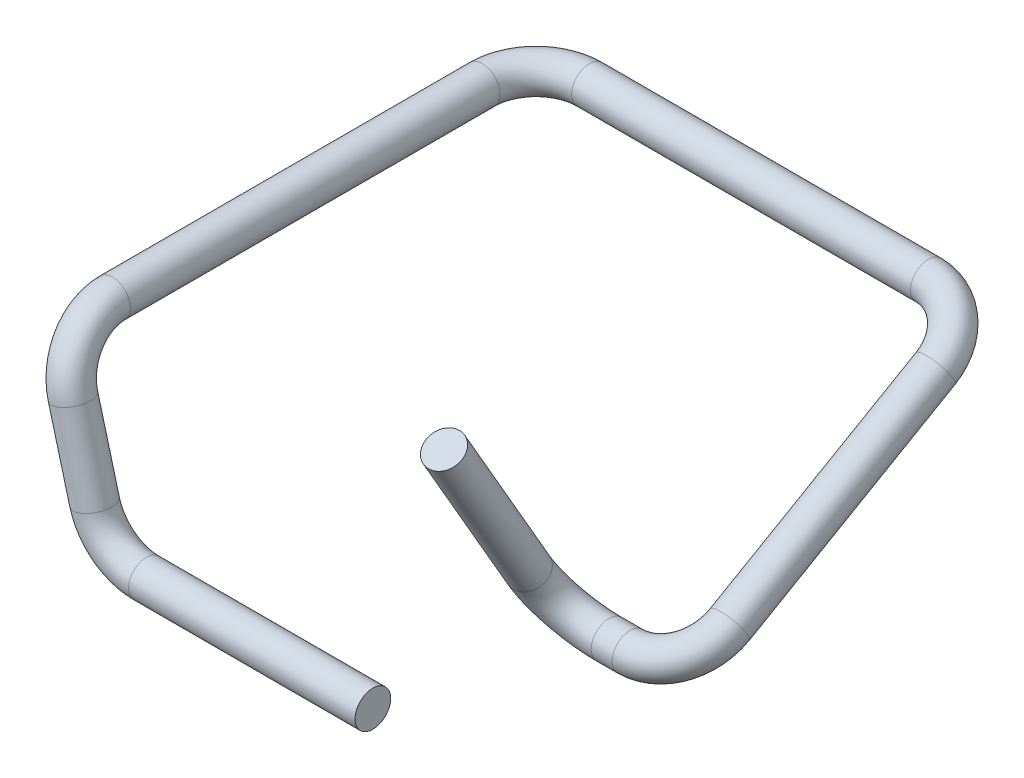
SolidWorks part; units mm, degrees
ref_plane "Front" through (0, 0, 0) normal (0, 0, 1) x (1, 0, 0)
ref_plane "Top" through (0, 0, 0) normal (0, 1, 0) x (1, 0, 0)
ref_plane "Right" through (0, 0, 0) normal (1, 0, 0) x (0, 0, -1)
sketch "setup" plane through (0, 0, 0) normal (0, 1, 0) x (1, 0, 0)
  line L1 (0, 0) -> (-150, 0)
  line L2 (0, 0) -> (0, 100)
  line L3 (0, 100) -> (-150, 100)
  line L4 (-150, 0) -> (-150, 100)
  dimension "D1" = 150
  dimension "D2" = 100
ref_plane "Angle 60" through (0, -43.3013, -25) normal (0, 0.866, 0.5) x (-1, 0, 0)
ref_plane "Angle 15" through (-139.9519, -37.5, 0) normal (0.9659, 0.2588, 0) x (0, 0, -1)
sketch3d "3DSketch1"
  line L0 (0, 0, 0) -> (-126.9802, 0, 0)
  line L1 (-155.958, 22.2354, 0) -> (-168.1173, 67.6148, 0)
  line L2 (-175.8819, 96.5926, -30) -> (-175.8819, 96.5926, -237.3033)
  line L3 (-145.8819, 96.5926, -267.3033) -> (44.1181, 96.5926, -267.3033)
  line L4 (74.1181, 81.5926, -241.3225) -> (74.1181, 15, -125.9808)
  line L5 (44.1181, 0, -100) -> (32.3976, 0, -100)
  line L6 (2.3976, 25.9808, -85) -> (2.3976, 108.2532, -37.5)
  arc A0 (-126.9802, 0, 0) -> (-155.958, 22.2354, 0) centre (-126.9802, 30, 0) ccw
  arc A1 (-168.1173, 67.6148, 0) -> (-175.8819, 96.5926, -30) centre (-168.1173, 67.6148, -30) ccw
  arc A2 (-175.8819, 96.5926, -237.3033) -> (-145.8819, 96.5926, -267.3033) centre (-145.8819, 96.5926, -237.3033) ccw
  arc A3 (44.1181, 96.5926, -267.3033) -> (74.1181, 81.5926, -241.3225) centre (44.1181, 81.5926, -241.3225) ccw
  arc A4 (74.1181, 15, -125.9808) -> (44.1181, 0, -100) centre (44.1181, 15, -125.9808) ccw
  arc A5 (32.3976, 0, -100) -> (2.3976, 25.9808, -85) centre (32.3976, 25.9808, -85) ccw
  point P11 (-150, 0, 0)
  point P12 (-126.9802, 30, -30)
  point P15 (-175.8819, 96.5926, 0)
  point P16 (-197.0951, 59.8502, -30)
  point P19 (-175.8819, 96.5926, -267.3033)
  point P20 (-145.8819, 66.5926, -237.3033)
  point P23 (74.1181, 96.5926, -267.3033)
  point P24 (44.1181, 55.6118, -256.3225)
  point P27 (74.1181, 0, -100)
  point P28 (44.1181, -10.9808, -140.9808)
  point P31 (2.3976, 0, -100)
  point P32 (32.3976, 40.9808, -110.9808)
  dimension "D4" = 30
  dimension "D5" = 30
  dimension "D6" = 30
  dimension "D7" = 30
  dimension "D8" = 30
  dimension "D9" = 30
  dimension "D1" = 250
  dimension "D2" = 100
  dimension "D3" = 125
sketch "Sketch1" plane through (0, 0, 0) normal (1, 0, 0) x (0, 0, -1)
  circle A0 centre (0, 0) radius 10
  dimension "D1" = 20
sweep "Sweep1" add profiles "Sketch1" path "3DSketch1"
